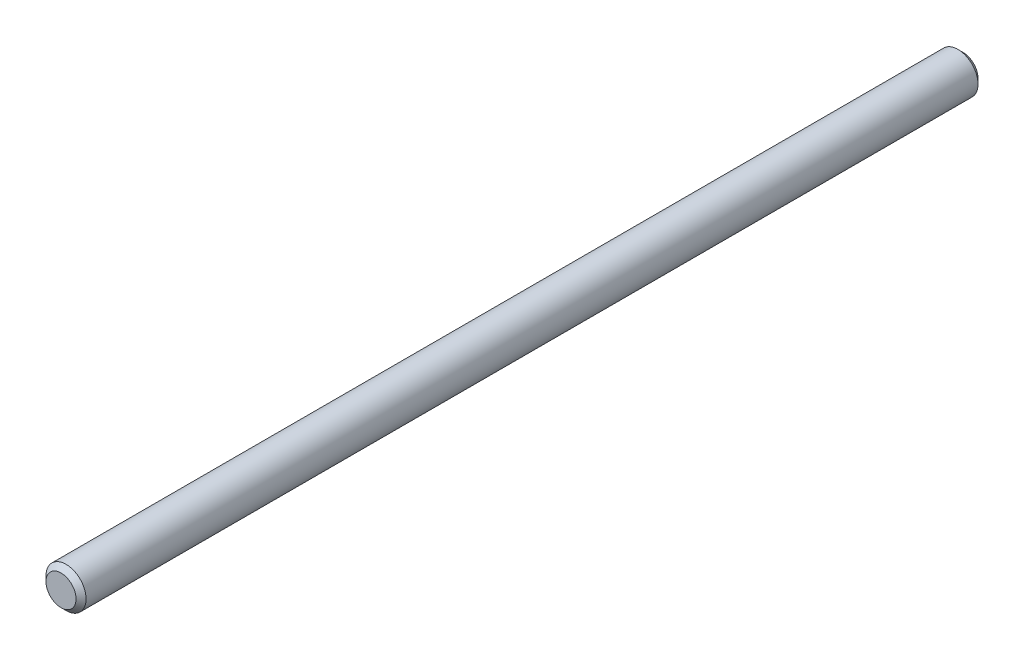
SolidWorks part; units mm, degrees
ref_plane "前视基准面" through (0, 0, 0) normal (0, 0, 1) x (1, 0, 0)
ref_plane "上视基准面" through (0, 0, 0) normal (0, 1, 0) x (1, 0, 0)
ref_plane "右视基准面" through (0, 0, 0) normal (1, 0, 0) x (0, 0, -1)
sketch "草图1" plane through (0, 0, 0) normal (0, 0, 1) x (1, 0, 0)
  circle A0 centre (0, 0) radius 2
extrude "凸台-拉伸1" add sketch "草图1" against normal blind 90
chamfer "倒角1" distance 0.5 angle 45 2 edges at (2, 0, -90) (2, 0, 0)
